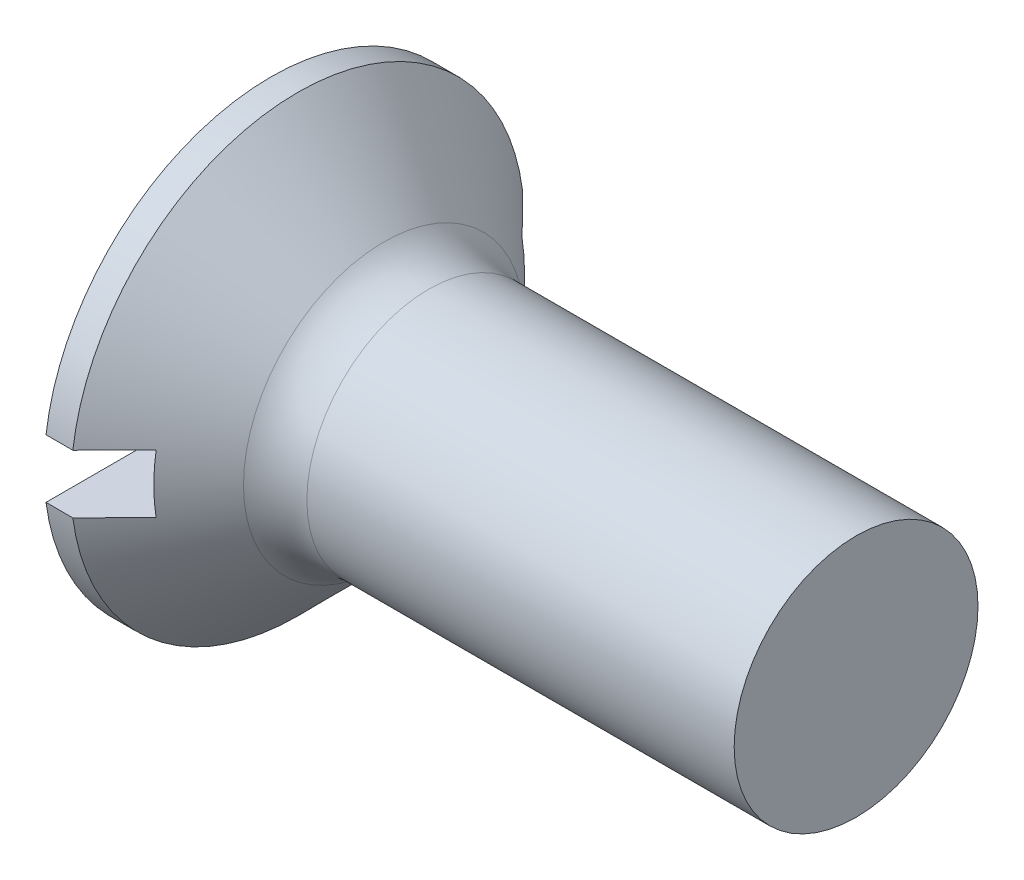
SolidWorks part; units mm, degrees
ref_plane "Plane1" through (0, 0, 0) normal (0, 0, 1) x (1, 0, 0)
ref_plane "Plane2" through (0, 0, 0) normal (0, 1, 0) x (1, 0, 0)
ref_plane "Plane3" through (0, 0, 0) normal (1, 0, 0) x (0, 0, -1)
sketch "BodySke" plane through (0, 0, 0) normal (0, 0, 1) x (1, 0, 0)
  line L0 (0, 0) -> (0, 4.65)
  line L1 (0, 4.65) -> (0.55, 4.65)
  line L2 (2.7, 2.5) -> (12, 2.5)
  line L3 (12, 2.5) -> (12, 0)
  line L4 (12, 0) -> (0, 0)
  line L5 (-6.35, 0) -> (82.55, 0) construction
  line L6 (2.7, -2.5) -> (12, -2.5) construction
  line L7 (0.55, -4.65) -> (2.7, -2.5) construction
  line L8 (0.55, 4.65) -> (2.7, 2.5)
  line L9 (0, -4.65) -> (0.55, -4.65) construction
  line L10 (3.5, 4.0875) -> (3.5, -5.4375) construction
  line L11 (0, 6.35) -> (0, -3.175) construction
  dimension "Diameter" = 5
  dimension "Length" = 12
  dimension "Head_ht" = 2.7
  dimension "Head_dia" = 9.3
  dimension "Head_ang" = 90
  dimension "D6" = 0.55
  dimension "Advance" = 0.8
  dimension "Thread_nom" = 12
revolve "Base-Revolve" add sketch "BodySke" angle 360 about L5
fillet "Fillet1" radius 1.3 1 edges at (2.7, 0, 2.5)
sketch "Sketch2" plane through (0, 0, 0) normal (-1, 0, 0) x (0, 0, 1)
  line L0 (-4.65, -0.6) -> (4.65, -0.6)
  line L1 (-4.65, -0.6) -> (-4.65, 0.6)
  line L2 (4.65, 0.6) -> (-4.65, 0.6)
  line L3 (4.65, 0.6) -> (4.65, -0.6)
  dimension "D1" = 0.6
  dimension "Slot_width" = 1.2
  dimension "D2" = 9.3
  dimension "D3" = 4.65
extrude "Slot" cut sketch "Sketch2" against normal blind 1.4
sketch "ThdSchSke" plane through (0, 0, 0) normal (0, 0, 1) x (1, 0, 0)
  line L0 (3.5, -2.055) -> (3.1884, -2.5)
  line L1 (3.5, -2.055) -> (3.8116, -2.5)
  line L2 (3.8116, -2.5) -> (3.8116, -3.125)
  line L3 (-3.175, 0) -> (5.1513, 0) construction
  line L5 (3.8116, -3.125) -> (3.1884, -3.125)
  line L6 (3.1884, -3.125) -> (3.1884, -2.5)
  line L7 (0, 4.65) -> (0, 0.6) construction
  dimension "Thread_minor" = 4.11
  dimension "Diameter" = 5
  dimension "Start" = 3.5
  dimension "SideAngle" = 55
  dimension "VeeAngle" = 70
  dimension "Overcut" = 6.25
revolve "ThreadSchematic" [suppressed] cut sketch "ThdSchSke" angle 360 about L3
pattern_linear "ThdSchPat" [suppressed]
equation "\"D1@Sketch2\" = \"Slot_width@Sketch2\" / 2"
equation "\"D2@Sketch2\" = \"Head_dia@BodySke\""
equation "\"D3@Sketch2\" = \"D2@Sketch2\" / 2"
equation "\"Thread_length@ThreadCosmetic\" = ((sgn( (\"Length@BodySke\" - \"Advance@BodySke\" * 1.0 - \"Head_ht@BodySke\" ) - \"Thread_nom@BodySke\" )-1)*( (\"Length@BodySke\" - \"Advance@BodySke\" * 1.0 - \"Head_ht@BodySke\" "
equation "\"Thread_minor@ThdSchSke\" = \"Thread_minor@ThreadCosmetic\""
equation "\"Diameter@ThdSchSke\" = \"Diameter@BodySke\""
equation "\"Overcut@ThdSchSke\" = \"Diameter@BodySke\" * 1.25"
equation "\"Start@ThdSchSke\" = 0.000001 + \"Length@BodySke\" - \"Thread_length@ThreadCosmetic\"  '---Countersunk---"
equation "\"Num_threads@ThdSchPat\" = int( \"Thread_length@ThreadCosmetic\" / \"Advance@BodySke\" + 0.999 )  + 1"
equation "\"Advance@ThdSchPat\" = \"Thread_length@ThreadCosmetic\" /  (\"Num_threads@ThdSchPat\" - 1) 'relax it"
